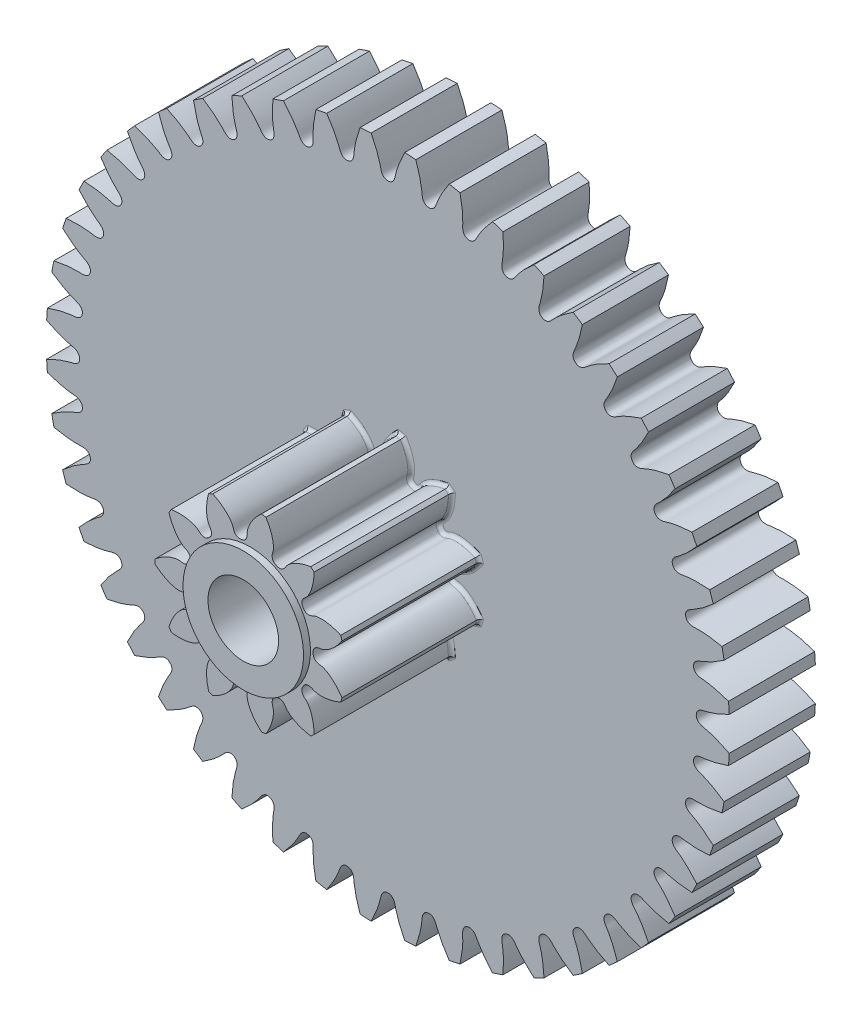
SolidWorks part; units mm, degrees
ref_plane "Front Plane" through (0, 0, 0) normal (0, 0, 1) x (1, 0, 0)
ref_plane "Top Plane" through (0, 0, 0) normal (0, 1, 0) x (1, 0, 0)
ref_plane "Right Plane" through (0, 0, 0) normal (1, 0, 0) x (0, 0, -1)
imported_body "Imported3"
sketch "Sketch1" plane through (0, 0, 0) normal (0, 1, 0) x (1, 0, 0)
  line L0 (2, 1.55) -> (0, 1.55)
  line L1 (0, 1.55) -> (0, 1.25)
  line L2 (0, 1.25) -> (2, 1.25)
  line L3 (2, 1.25) -> (2, 1.55)
  line L4 (0, 1.55) -> (0, 1.25) construction
revolve "Revolve1" add sketch "Sketch1" angle 360 about L4
ref_plane "Plane1" through (0, 0, 0) normal (0, -1, 0) x (1, 0, 0)
sketch "Sketch2" plane through (0, 0, 0) normal (0, -1, 0) x (1, 0, 0)
  line L0 (1.75, 5.45) -> (0, 5.45)
  line L1 (0, 5.45) -> (0, 5.25)
  line L2 (0, 5.25) -> (1.75, 5.25)
  line L3 (1.75, 5.25) -> (1.75, 5.45)
  line L4 (0, 5.45) -> (0, 5.25) construction
revolve "Revolve2" add sketch "Sketch2" angle 360 about L4
hole_wizard "#1 Clearance Hole1" positions "Sketch4" profile "Sketch3" hole size "#1" standard "ANSI Inch"
sketch "Sketch4" plane through (0, 0, 5.45) normal (0, 0, 1) x (1, 0, 0)
  point P0 (0, 0)
sketch "Sketch3" plane through (0, 0, 5.45) normal (1, 0, 0) x (0, -1, 0)
  line L0 (0, 0) -> (0, 7)
  line L1 (0, 7) -> (1.025, 7)
  line L2 (1.025, 7) -> (1.025, 0)
  line L5 (1.025, 0) -> (0, 0)
  line L11 (0, -6.35) -> (0, 107.95) construction
  dimension "Thru Hole Dia." = 2.05
  dimension "Thru Hole Depth" = 7
fillet "Fillet1" radius 0.1 11 edges
